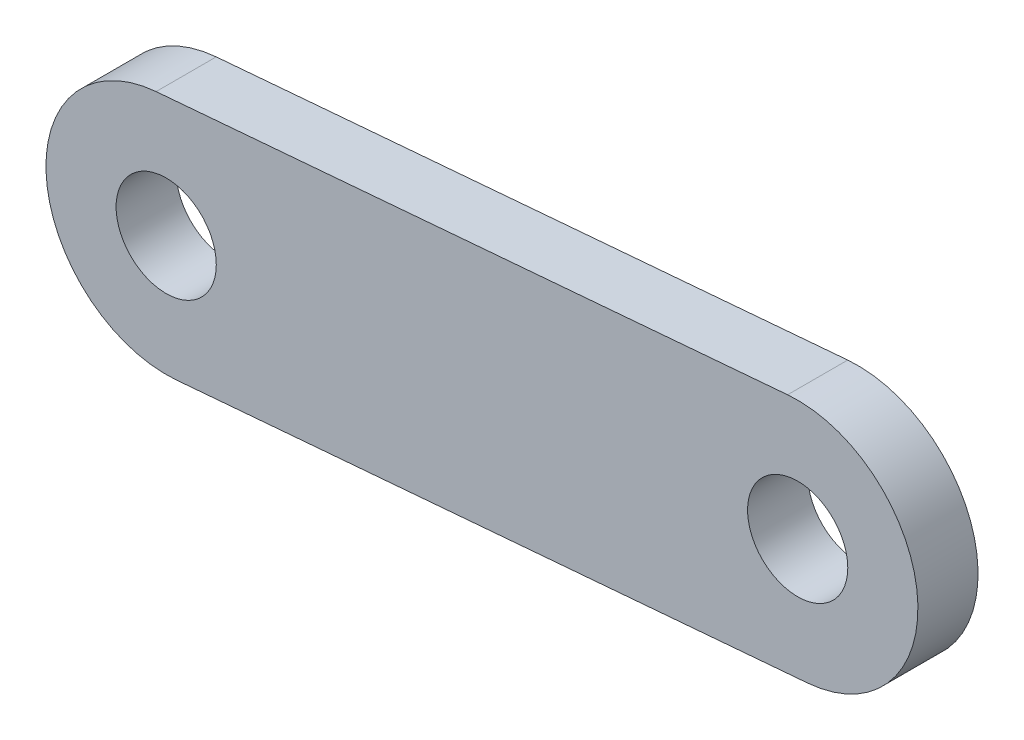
SolidWorks part; units mm, degrees
ref_plane "Alzado" through (0, 0, 0) normal (0, 0, 1) x (1, 0, 0)
ref_plane "Planta" through (0, 0, 0) normal (0, 1, 0) x (1, 0, 0)
ref_plane "Vista lateral" through (0, 0, 0) normal (1, 0, 0) x (0, 0, -1)
sketch "Croquis1" plane through (0, 0, 0) normal (0, 0, 1) x (1, 0, 0)
  line L0 (-15.7012, -2.6541) -> (15.81, 0) construction
  line L1 (-15.7012, -2.6541) -> (-15.1976, -8.6329) construction
  line L2 (-15.1976, -8.6329) -> (49808.3852, 4187.8645) construction
  line L3 (15.81, 0) -> (16.3136, -5.9788) construction
  line L5 (15.3064, 5.9788) -> (-16.2048, 3.3247)
  line L7 (-15.1976, -8.6329) -> (16.3136, -5.9788)
  circle A4 centre (15.81, 0) radius 2.5 construction
  circle A5 centre (-15.7012, -2.6541) radius 2.5 construction
  circle A6 centre (15.81, 0) radius 2.5
  circle A7 centre (-15.7012, -2.6541) radius 2.5
  arc A8 (-21.5325, -1.2412) -> (-9.8699, -4.067) centre (-15.7012, -2.6541) ccw construction
  arc A9 (-21.5325, -1.2412) -> (-9.8699, -4.067) centre (-15.7012, -2.6541) ccw construction
  arc A10 (-15.1976, -8.6329) -> (-16.2048, 3.3247) centre (-15.7012, -2.6541) cw
  arc A11 (16.3136, -5.9788) -> (15.3064, 5.9788) centre (15.81, 0) ccw
extrude "Saliente-Extruir1" add sketch "Croquis1" along normal mid plane 3
